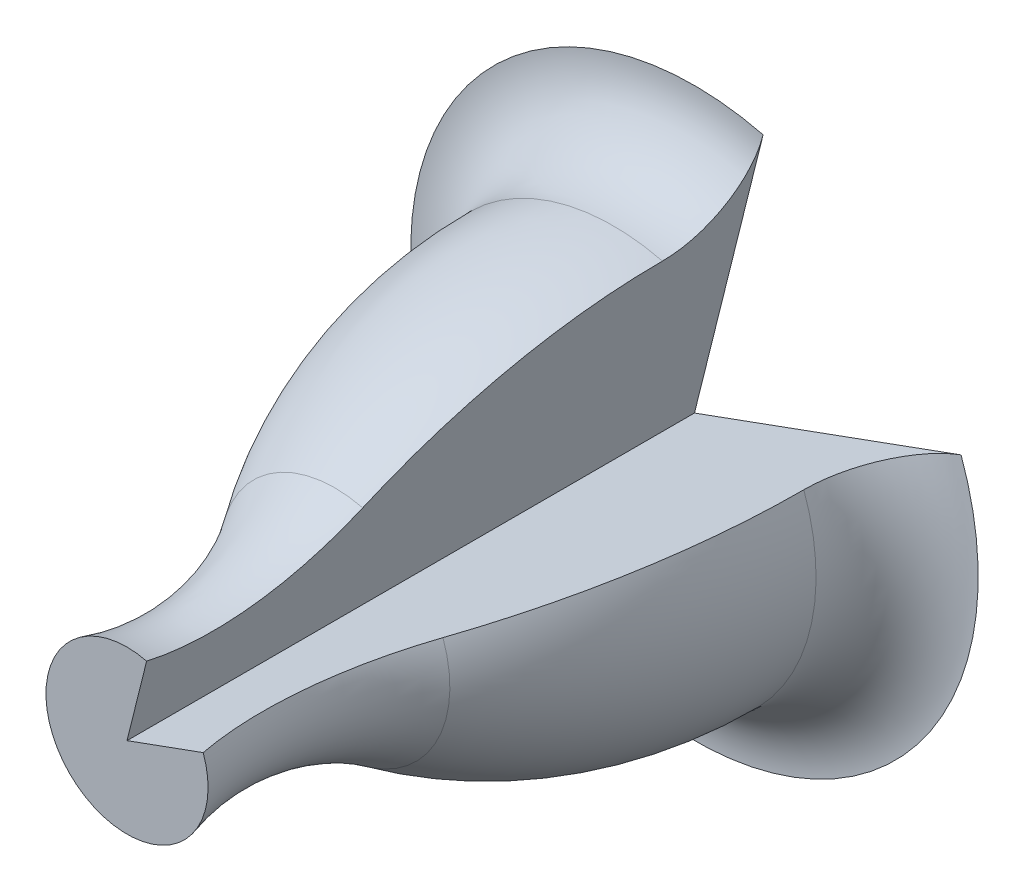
SolidWorks part; units mm, degrees
ref_plane "Front Plane" through (0, 0, 0) normal (0, 0, 1) x (1, 0, 0)
ref_plane "Top Plane" through (0, 0, 0) normal (0, 1, 0) x (1, 0, 0)
ref_plane "Right Plane" through (0, 0, 0) normal (1, 0, 0) x (0, 0, -1)
sketch "Sketch1" plane through (0, 0, 0) normal (0, -1, 0) x (1, 0, 0)
  line L0 (0, 0) -> (-35, 0)
  line L1 (-10, 70) -> (0, 70)
  line L2 (0, 70) -> (0, 0)
  arc A0 (-35, 0) -> (-25, 10) centre (-35, 10) ccw
  arc A1 (-25, 10) -> (-14.188, 44.359) centre (35, 10) cw
  arc A2 (-14.188, 44.359) -> (-10, 70) centre (-38.782, 61.5385) ccw
  dimension "D1" = 60
  dimension "D2" = 30
  dimension "D3" = 10
  dimension "D4" = 35
  dimension "D5" = 70
  dimension "D6" = 10
revolve "Revolve1" add sketch "Sketch1" angle 200 about L2
